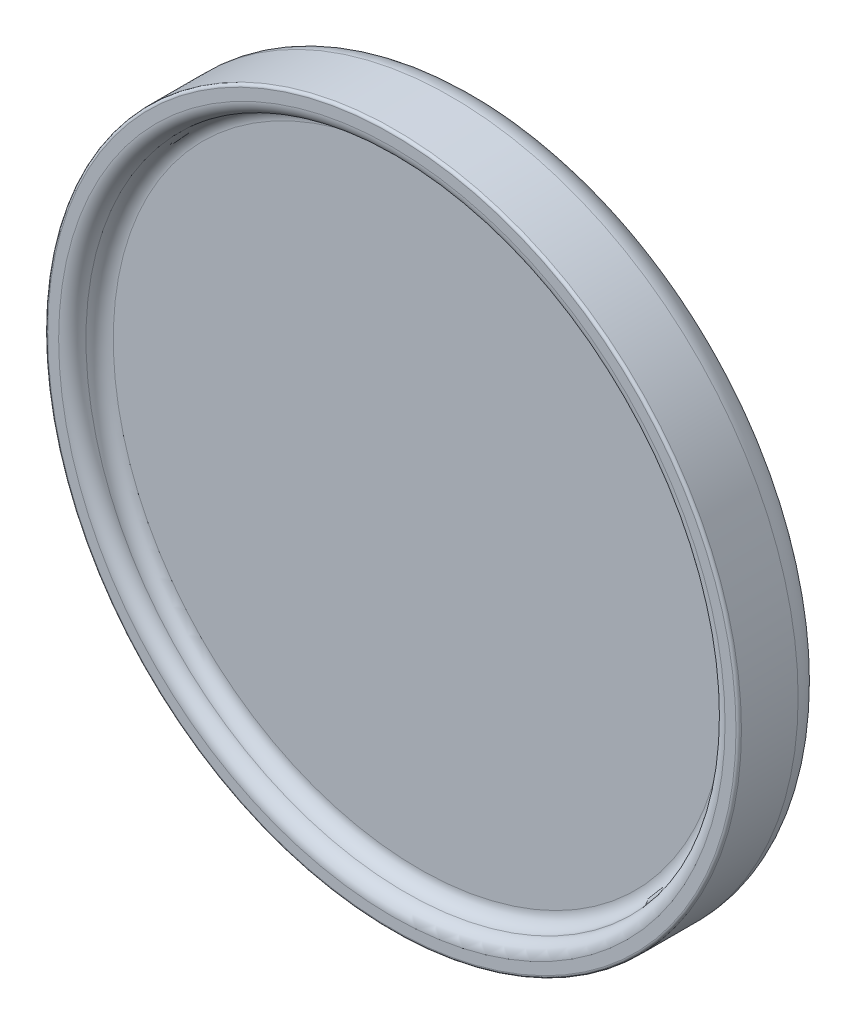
SolidWorks part; units mm, degrees
extrude "Base-Extrude" add sketch "Sketch1" against normal blind 31.75
sketch "Sketch1" plane through (0, 0, 0) normal (0, 0, 1) x (1, 0, 0)
  circle A0 centre (0, 0) radius 127
  dimension "D1" = 254
ref_plane "Front" through (0, 0, 0) normal (0, 0, 1) x (1, 0, 0)
ref_plane "Top" through (0, 0, 0) normal (0, 1, 0) x (1, 0, 0)
ref_plane "Right" through (0, 0, 0) normal (1, 0, 0) x (0, 0, -1)
sketch "Sketch3" plane through (0, 0, 0) normal (0, 0, 1) x (1, 0, 0)
  circle A2 centre (0, 0) radius 117
  circle A3 centre (0, 0) radius 117
  dimension "D1" = 10
extrude "Cut-Extrude1" cut sketch "Sketch3" against normal blind 10
fillet "Fillet1" radius 5 1 edges at (117, 0, 0)
fillet "Fillet2" radius 5 1 edges at (117, 0, -10)
fillet "Fillet3" radius 1 1 edges at (127, 0, 0)
fillet "Fillet4" radius 10 1 edges at (127, 0, -31.75)
scale "Scale2" scale about centroid uniform scaling yes scale factor 1.2
